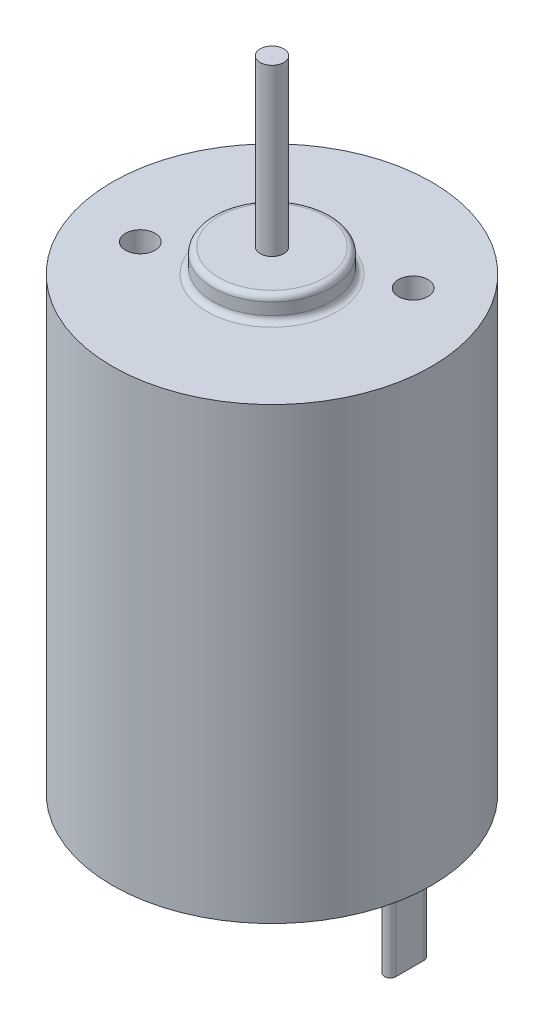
SolidWorks part; units mm, degrees
ref_plane "前视基准面" through (0, 0, 0) normal (0, 0, 1) x (1, 0, 0)
ref_plane "上视基准面" through (0, 0, 0) normal (0, 1, 0) x (1, 0, 0)
ref_plane "右视基准面" through (0, 0, 0) normal (1, 0, 0) x (0, 0, -1)
other "Configuration Table"
sketch "草图1" plane through (0, 0, 0) normal (0, 0, 1) x (1, 0, 0)
  line L0 (0, 0) -> (1, 0)
  line L1 (1, 0) -> (1, 6)
  line L2 (1, 6) -> (5, 6)
  line L3 (5, 6) -> (5, 8)
  line L4 (5, 8) -> (13.5, 8)
  line L5 (13.5, 8) -> (13.5, 46)
  line L6 (13.5, 46) -> (5, 46)
  line L7 (5, 46) -> (5, 48)
  line L8 (5, 48) -> (1, 48)
  line L9 (1, 48) -> (1, 62)
  line L10 (1, 62) -> (0, 62)
  line L11 (0, 62) -> (0, 0) construction
  line L12 (0, 0) -> (0, 62)
  dimension "D1" = 2
  dimension "D2" = 6
  dimension "D3" = 27
  dimension "D4" = 2
  dimension "D5" = 10
  dimension "D6" = 38
  dimension "D7" = 14
revolve "旋转1" add sketch "草图1" angle 360 about L11
sketch "草图2" plane through (0, 8, 0) normal (0, -1, 0) x (1, 0, 0)
  line L0 (11.1805, 1.1855) -> (11.1805, -1.1855) construction
  line L1 (11.6686, 1.1855) -> (11.6686, -1.1855)
  line L2 (10.6924, 1.1855) -> (10.6924, -1.1855)
  line L3 (0, 0) -> (0, 9.1234) construction
  line L4 (-11.1805, 1.1855) -> (-11.1805, -1.1855) construction
  line L5 (-11.6686, 1.1855) -> (-11.6686, -1.1855)
  line L6 (-10.6924, 1.1855) -> (-10.6924, -1.1855)
  arc A0 (11.6686, 1.1855) -> (10.6924, 1.1855) centre (11.1805, 1.1855) ccw
  arc A1 (10.6924, -1.1855) -> (11.6686, -1.1855) centre (11.1805, -1.1855) ccw
  arc A2 (-11.6686, 1.1855) -> (-10.6924, 1.1855) centre (-11.1805, 1.1855) cw
  arc A3 (-10.6924, -1.1855) -> (-11.6686, -1.1855) centre (-11.1805, -1.1855) cw
  point P2 (11.1805, 0)
  point P12 (-11.1805, 0)
extrude "凸台-拉伸1" add sketch "草图2" along normal blind 7
fillet "圆角1" radius 0.5 2 edges at (-5, 48, 0) (-5, 46, 0)
fillet "圆角2" radius 0.5 2 edges at (-5, 6, 0) (-5, 8, 0)
hole_wizard "M3 螺纹孔2" positions "草图6" profile "草图7" tap size "M3" standard "GB"
sketch "草图6" plane through (0, 46, 0) normal (0, 1, 0) x (1, 0, 0)
  point P0 (6.9819, 4.9501)
  point P3 (-7.9401, -3.1945)
sketch "草图7" plane through (6.9819, 46, -4.9501) normal (1, 0, 0) x (0, 0, 1)
  line L0 (0, 0) -> (0, 3.7511)
  line L1 (0, 3.7511) -> (1.25, 3)
  line L2 (1.25, 3) -> (1.25, 0)
  line L5 (1.25, 0) -> (0, 0)
  line L10 (0, 3.7511) -> (-1.25, 3) construction
  line L11 (0, -6.35) -> (0, 107.95) construction
  dimension "螺纹孔钻头直径" = 2.5
  dimension "螺纹孔钻头深度" = 3
  dimension "导头角度" = 118
